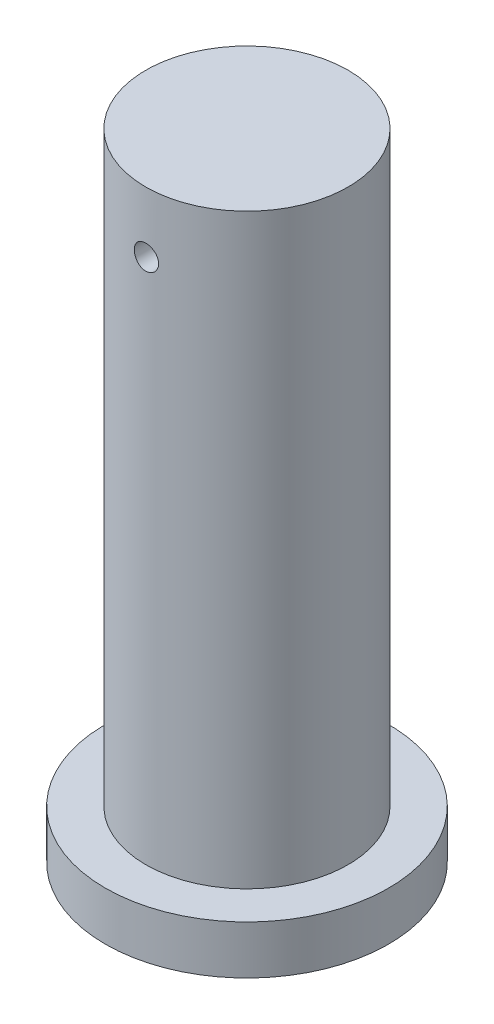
SolidWorks part; units mm, degrees
ref_plane "Front Plane" through (0, 0, 0) normal (1, 0, 0) x (0, 1, 0)
ref_plane "Top Plane" through (0, 0, 0) normal (0, 0, 1) x (0, 1, 0)
ref_plane "Right Plane" through (0, 0, 0) normal (0, 1, 0) x (-1, 0, 0)
sketch "Sketch1" plane through (0, 0, 0) normal (1, 0, 0) x (0, 1, 0)
  line L0 (0, 0) -> (-157, 0)
  line L1 (-157, 0) -> (-157, 35)
  line L2 (-157, 35) -> (-145, 35)
  line L3 (-145, 35) -> (-145, 25)
  line L4 (-145, 25) -> (0, 25)
  line L5 (0, 25) -> (0, 0)
  dimension "D1" = 35
  dimension "D2" = 12
  dimension "D3" = 25
  dimension "D4" = 157
revolve "Revolve1" add sketch "Sketch1" angle 360 about L0
sketch "Sketch2" plane through (0, 0, 0) normal (0, 0, 1) x (0, 1, 0)
  line L0 (-145, -35) -> (-145, 35) construction
  circle A0 centre (-15, 0) radius 3
  point P4 (0, 0)
  point P6 (0, 0)
  dimension "D1" = 6
  dimension "D2" = 130
extrude "Cut-Extrude1" cut sketch "Sketch2" against normal through all both and the other way through all contours A0
